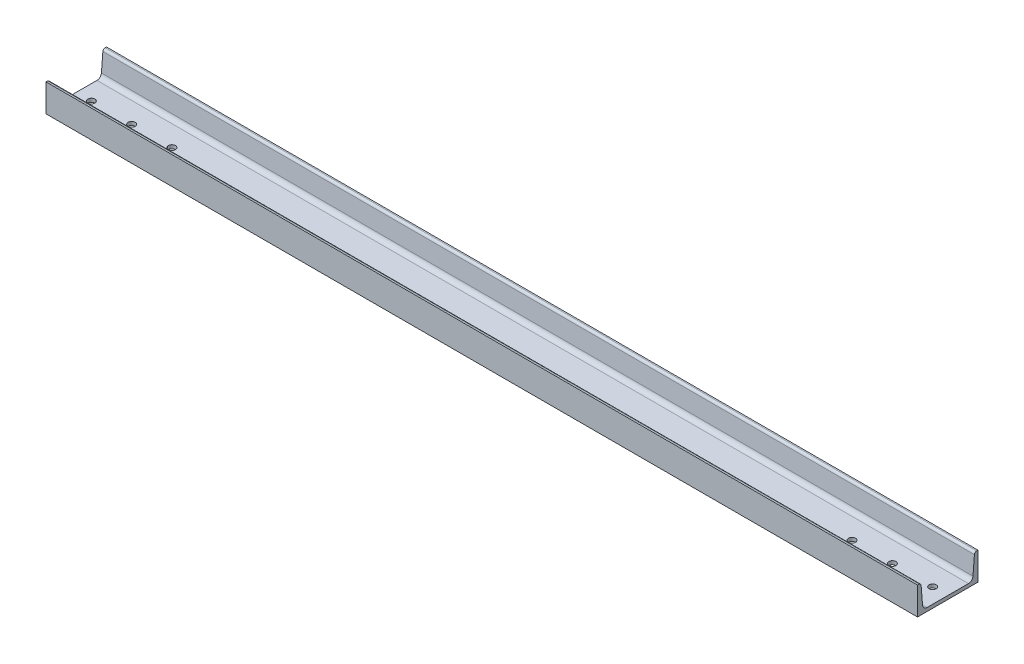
SolidWorks part; units mm, degrees
ref_plane "Plan1" through (0, 0, 0) normal (0, 0, 1) x (1, 0, 0)
ref_plane "Plan2" through (0, 0, 0) normal (0, 1, 0) x (1, 0, 0)
ref_plane "Plan3" through (0, 0, 0) normal (1, 0, 0) x (0, 0, -1)
sketch "Esquisse1" plane through (0, 0, 0) normal (1, 0, 0) x (0, 0, -1)
  line L0 (0, 0) -> (0, 55) construction
  line L1 (-60, 0) -> (60, 0)
  line L2 (60, 0) -> (60, 55)
  line L3 (60, 55) -> (57.3528, 55)
  line L4 (52.8671, 50.8585) -> (50.0235, 15.2829)
  line L5 (41.0521, 7) -> (-41.0521, 7)
  line L6 (-52.8671, 50.8585) -> (-50.0235, 15.2829)
  line L7 (-60, 55) -> (-57.3528, 55)
  line L8 (-60, 0) -> (-60, 55)
  line L10 (60, 27.5) -> (51, 27.5) construction
  arc A0 (50.0235, 15.2829) -> (41.0521, 7) centre (41.0521, 16) cw
  arc A1 (57.3528, 55) -> (52.8671, 50.8585) centre (57.3528, 50.5) ccw
  arc A2 (-57.3528, 55) -> (-52.8671, 50.8585) centre (-57.3528, 50.5) cw
  arc A3 (-50.0235, 15.2829) -> (-41.0521, 7) centre (-41.0521, 16) ccw
  point P18 (0, 7)
  dimension "R" = 9
  dimension "r1" = 4.5
  dimension "A" = 7
  dimension "D3" = 4.57
  dimension "B" = 55
  dimension "H" = 120
  dimension "A1" = 9
extrude "Base-Extrusion" add sketch "Esquisse1" along normal mid plane 1730
sketch "Esquisse2" plane through (0, 0, 0) normal (0, -1, 0) x (1, 0, 0)
  line L0 (865, 60) -> (865, -60) construction
  line L1 (865, -60) -> (-865, -60) construction
  circle A0 centre (835, 0) radius 7
  circle A1 centre (755, 0) radius 7
  circle A2 centre (675, 0) radius 7
  dimension "D4" = 14
  dimension "D5" = 14
  dimension "D6" = 14
  dimension "D8" = 60
  dimension "D1" = 30
  dimension "D2" = 80
  dimension "D3" = 80
  dimension "D7" = 60
  dimension "D9" = 60
extrude "Enlèv. mat.-Extru.1" cut sketch "Esquisse2" against normal through all
mirror "Symétrie1" about plane through (0, 0, 0) normal (1, 0, 0) of "Enlèv. mat.-Extru.1"
